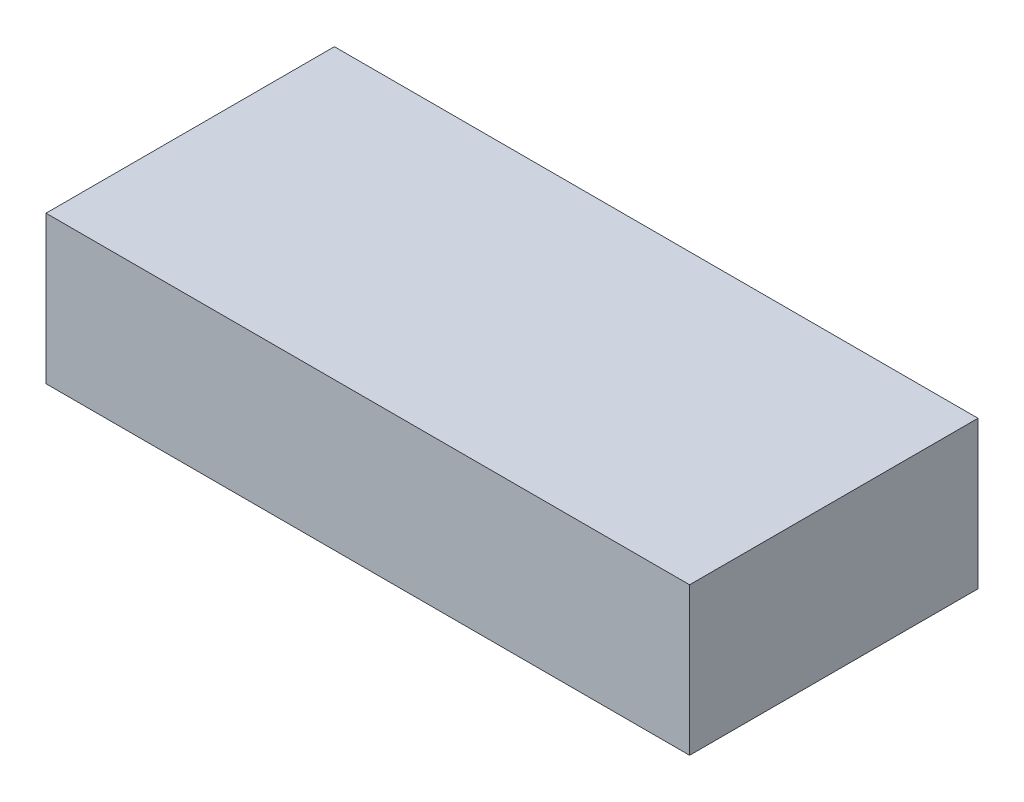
SolidWorks part; units mm, degrees
ref_plane "Front Plane" through (0, 0, 0) normal (0, 0, 1) x (1, 0, 0)
ref_plane "Top Plane" through (0, 0, 0) normal (0, 1, 0) x (1, 0, 0)
ref_plane "Right Plane" through (0, 0, 0) normal (1, 0, 0) x (0, 0, -1)
sketch "Sketch1" plane through (0, 0, 0) normal (0, 1, 0) x (1, 0, 0)
  line L1 (0, 0) -> (91.5, 0)
  line L2 (0, 0) -> (0, 41)
  line L3 (0, 41) -> (91.5, 41)
  line L4 (91.5, 0) -> (91.5, 41)
  dimension "D1" = 91.5
  dimension "D2" = 41
extrude "Boss-Extrude1" add sketch "Sketch1" along normal blind 21
